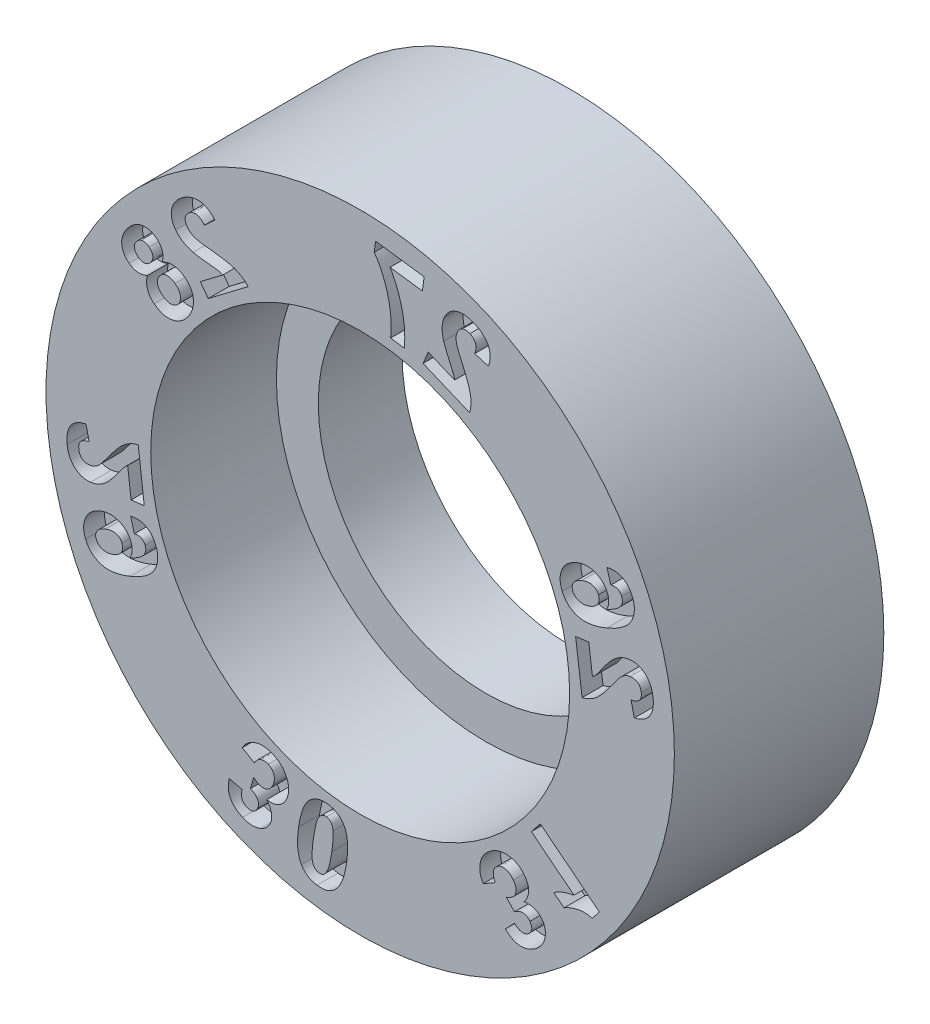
SolidWorks part; units mm, degrees
ref_plane "Front Plane" through (0, 0, 0) normal (0, 0, 1) x (1, 0, 0)
ref_plane "Top Plane" through (0, 0, 0) normal (0, 1, 0) x (1, 0, 0)
ref_plane "Right Plane" through (0, 0, 0) normal (1, 0, 0) x (0, 0, -1)
imported_body "Imported1"
other "DeleteFace2"
sketch "Sketch1" plane through (0, 0, 0) normal (0, 0, 1) x (1, 0, 0)
  line L0 (0, 0) -> (0, 8.7827) construction
  line L1 (0, 0) -> (7.606, 4.3913) construction
  line L2 (0, 0) -> (7.606, -4.3913) construction
  line L3 (0, 0) -> (0, -8.7827) construction
  line L4 (0, 0) -> (-7.606, -4.3913) construction
  line L5 (0, 0) -> (-7.606, 4.3913) construction
  circle A0 centre (0, 0) radius 5.3057 construction
  text T0 "26    27    28    29    30    31" font "Arial" height 1.8
  point P11 (0, 0)
  dimension "D1" = 6
extrude "Cut-Extrude1" cut sketch "Sketch1" against normal blind 0.5
